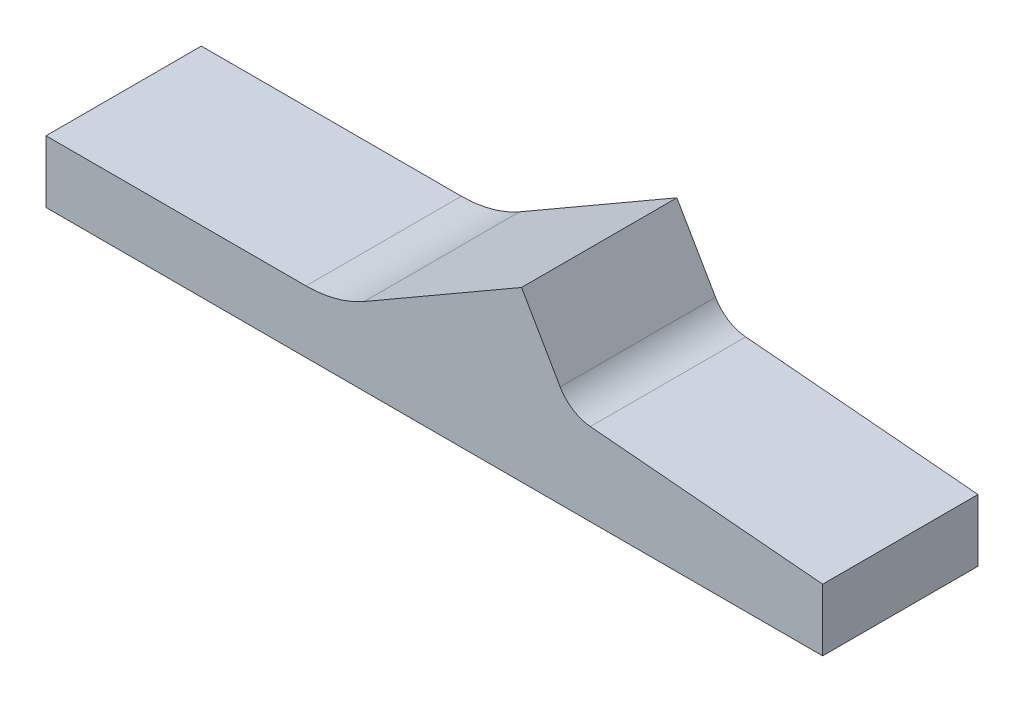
SolidWorks part; units mm, degrees
ref_plane "Plan de face" through (0, 0, 0) normal (0, 0, 1) x (1, 0, 0)
ref_plane "Plan de dessus" through (0, 0, 0) normal (0, 1, 0) x (1, 0, 0)
ref_plane "Plan de droite" through (0, 0, 0) normal (1, 0, 0) x (0, 0, -1)
sketch "Esquisse1" plane through (0, 0, 0) normal (0, 0, 1) x (1, 0, 0)
  line L0 (0, 0) -> (66.9615, 0)
  line L1 (81.9615, 4.0192) -> (122.4624, 27.4025)
  line L2 (122.4624, 27.4025) -> (132.3972, 10.195)
  line L3 (140.1859, 5.2331) -> (200, 0)
  line L4 (200, 0) -> (200, -16)
  line L5 (200, -16) -> (0, -16)
  line L6 (0, -16) -> (0, 0)
  arc A0 (66.9615, 0) -> (81.9615, 4.0192) centre (66.9615, 30) ccw
  arc A1 (132.3972, 10.195) -> (140.1859, 5.2331) centre (141.0574, 15.195) ccw
  point P13 (75, 0)
  point P16 (135, 5.6868)
  dimension "D9" = 30
  dimension "D10" = 10
  dimension "D1" = 200
  dimension "D2" = 16
  dimension "D3" = 16
  dimension "D4" = 75
  dimension "D5" = 65
  dimension "D6" = 5
  dimension "D7" = 60
  dimension "D8" = 30
extrude "Boss.-Extru.1" add sketch "Esquisse1" along normal mid plane 40
ref_plane "Plan1" through (0, 0, 20) normal (-1, 0, 0) x (0, 0, 1)
sketch "Esquisse4" plane through (0, 0, 0) normal (0, 0, 1) x (1, 0, 0)
  line L0 (66.9615, 0) -> (0, 0) construction
  line L1 (122.4624, 27.4025) -> (81.9615, 4.0192) construction
  line L2 (132.3972, 10.195) -> (122.4624, 27.4025) construction
  line L3 (200, 0) -> (140.1859, 5.2331) construction
  line L4 (200, 0) -> (140.1859, 5.2331) construction
  line L5 (132.3972, 10.195) -> (122.4624, 27.4025) construction
  line L6 (122.4624, 27.4025) -> (81.9615, 4.0192)
  line L7 (66.9615, 0) -> (0, 0)
  line L8 (144.3972, 10.195) -> (134.4624, 27.4025)
  line L9 (212, 0) -> (152.1859, 5.2331)
  line L10 (122.4624, 27.4025) -> (134.4624, 27.4025)
  arc A0 (66.9615, 0) -> (81.9615, 4.0192) centre (66.9615, 30) ccw construction
  arc A1 (132.3972, 10.195) -> (140.1859, 5.2331) centre (141.0574, 15.195) ccw construction
  arc A2 (132.3972, 10.195) -> (140.1859, 5.2331) centre (141.0574, 15.195) ccw construction
  arc A3 (66.9615, 0) -> (81.9615, 4.0192) centre (66.9615, 30) ccw
  arc A4 (144.3972, 10.195) -> (152.1859, 5.2331) centre (153.0574, 15.195) ccw
  dimension "D2" = 12
  dimension "D1" = 2
